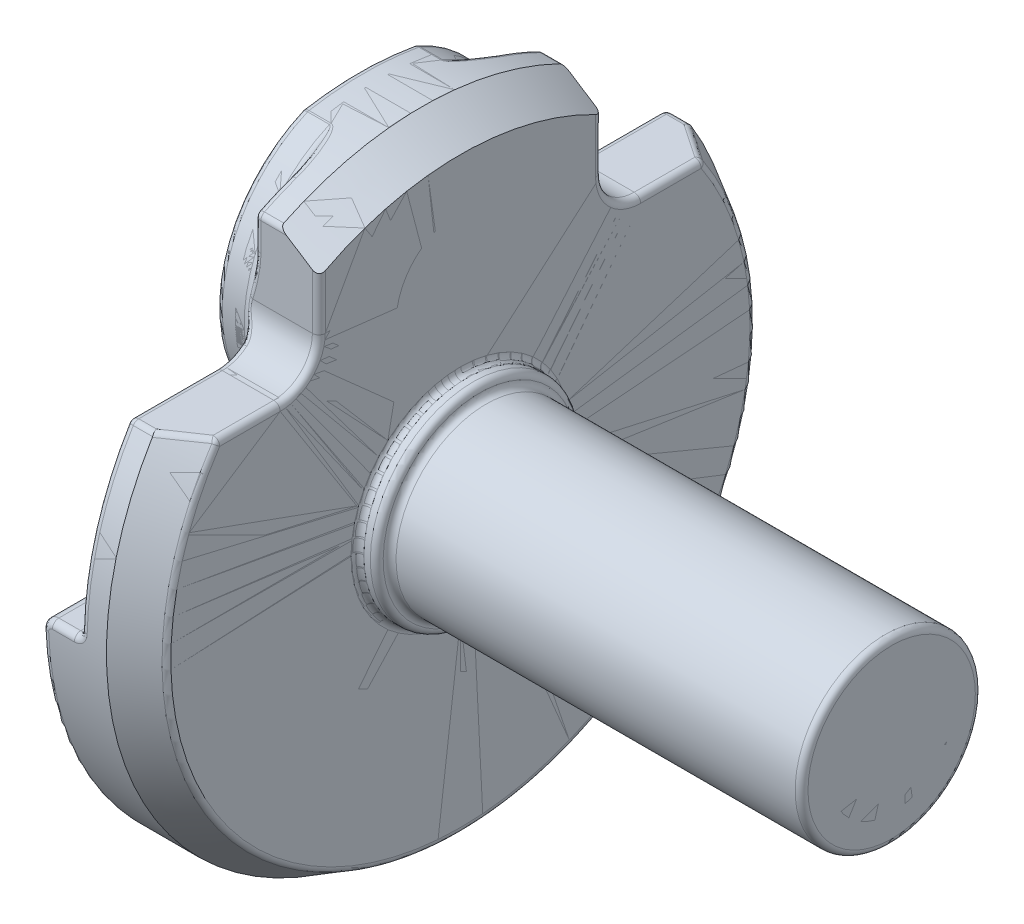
SolidWorks part; units mm, degrees
ref_plane "Plan de face" through (0, 0, 0) normal (0, 0, 1) x (1, 0, 0)
ref_plane "Plan de dessus" through (0, 0, 0) normal (0, 1, 0) x (1, 0, 0)
ref_plane "Plan de droite" through (0, 0, 0) normal (1, 0, 0) x (0, 0, -1)
imported_body "Importée1"
sketch "Esquisse1" plane through (0, 0, 0) normal (1, 0, 0) x (0, 0, -1)
  circle A0 centre (0, 0) radius 6
  dimension "D1" = 12
extrude "MiP-Roult" cut sketch "Esquisse1" along normal through all flip side to cut
ref_plane "Plan1" through (23, 0, 0) normal (1, 0, 0) x (0, 0, -1)
sketch "Esquisse2" plane through (23, 0, 0) normal (1, 0, 0) x (0, 0, -1)
  circle A0 centre (0, 0) radius 6 construction
  circle A1 centre (0, 0) radius 6
extrude "Enlèv. mat.-Extru.2" cut sketch "Esquisse2" along normal through all draft 5.71 flip side to cut
sketch "Esquisse3" plane through (33, 0, 0) normal (1, 0, 0) x (0, 0, -1)
  circle A0 centre (0, 0) radius 2.5
  dimension "D1" = 5
extrude "Enlèv. mat.-Extru.3" cut sketch "Esquisse3" against normal blind 17
chamfer "Chanfrein1" distance 1 angle 30 1 edges at (33, 0, -2.5)
chamfer "Chanfrein2" distance 0.2 angle 45 1 edges at (33, 0, -5.0001)
sketch "Esquisse4" plane through (0, 0, 0) normal (1, 0, 0) x (0, 0, -1)
  line L0 (0, 22.8824) -> (0, -22.8824) construction
  circle A0 centre (0, 14) radius 5
  dimension "D2" = 10
  dimension "D1" = 14
extrude "L-Radiale_Maneton" cut sketch "Esquisse4" against normal through all
ref_plane "Plan2" through (-7, 0, 0) normal (1, 0, 0) x (0, 0, -1)
sketch "Esquisse5" plane through (-7, 0, 0) normal (1, 0, 0) x (0, 0, -1)
  circle A0 centre (0, 14) radius 11
  circle A1 centre (0, 14) radius 5 construction
  arc A2 (-4.3747, 24.0927) -> (4.3747, 24.0927) centre (0, 14) ccw construction
extrude "Enlèv. mat.-Extru.5" cut sketch "Esquisse5" against normal through all
